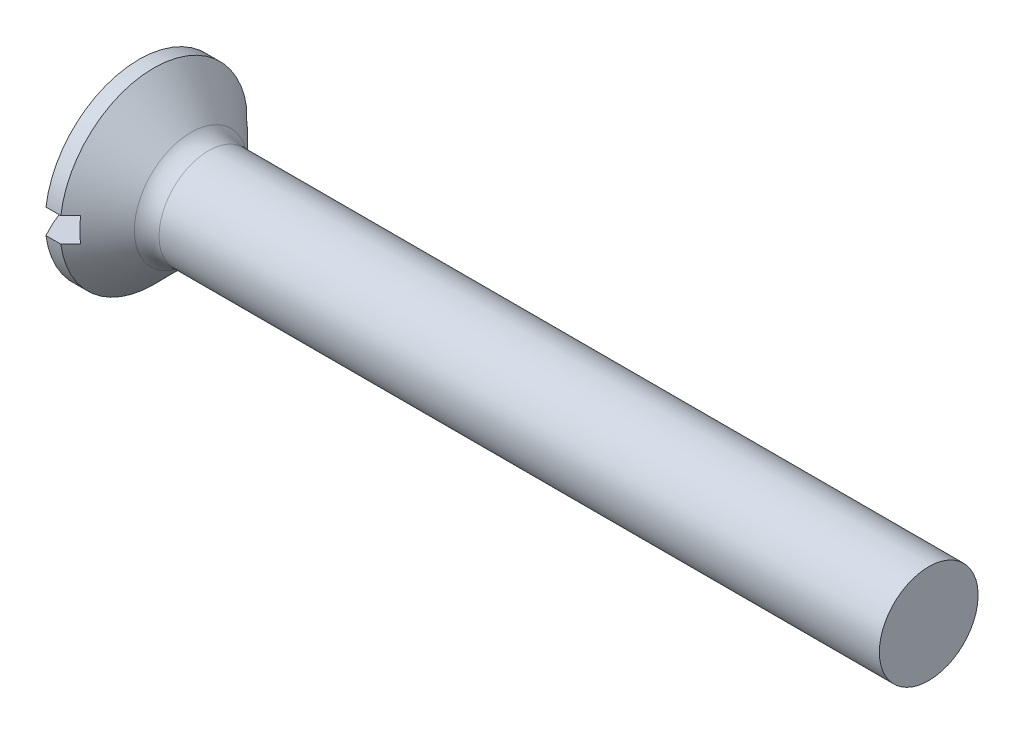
SolidWorks part; units mm, degrees
ref_plane "Plane1" through (0, 0, 0) normal (0, 0, 1) x (1, 0, 0)
ref_plane "Plane2" through (0, 0, 0) normal (0, 1, 0) x (1, 0, 0)
ref_plane "Plane3" through (0, 0, 0) normal (1, 0, 0) x (0, 0, -1)
revolve "Base-Revolve" add sketch "BodySke"
sketch "BodySke" plane through (0, 0, 0) normal (0, 0, 1) x (1, 0, 0)
  line L0 (0, 0) -> (16.5, 0)
  line L1 (16.5, 0) -> (16.5, 1)
  line L2 (16.5, 1) -> (1.7, 1)
  line L3 (0.8, -1.9) -> (1.7, -1) construction
  line L4 (-15.875, 0) -> (82.55, 0) construction
  line L5 (0.8, 1.9) -> (1.7, 1)
  line L6 (2.1, 4.175) -> (2.1, -11.7) construction
  line L7 (0.5, 2.7793) -> (0.5, -13.0957) construction
  line L8 (0.8, 1.9) -> (0.5, 1.9)
  arc A0 (0, 0) -> (0.5, 1.9) centre (3.86, 0) cw
  dimension "Length" = 16
  dimension "Diameter" = 2
  dimension "Head_dia" = 3.8
  dimension "Head_ang" = 90
  dimension "Advance" = 0.4
  dimension "Thread_nom" = 16
  dimension "Oval_ht" = 0.5
  dimension "Side_ht" = 1.2
extrude "Slot" cut sketch "Sketch2" along normal blind 1
sketch "Sketch2" plane through (0, 0, 0) normal (1, 0, 0) x (0, 0, -1)
  line L0 (1.9, -0.25) -> (-1.9, -0.25)
  line L1 (1.9, -0.25) -> (1.9, 0.25)
  line L2 (-1.9, 0.25) -> (1.9, 0.25)
  line L3 (-1.9, 0.25) -> (-1.9, -0.25)
  dimension "D1" = 3.8
  dimension "Slot_width" = 0.5
  dimension "D3" = 1.9
  dimension "D4" = 0.25
fillet "Fillet1" radius 0.5 1 edges at (1.7, 0, 1)
sketch "ThdSchSke" plane through (0, 0, 0) normal (0, 0, 1) x (1, 0, 0)
  line L0 (2.1, -0.774) -> (1.9418, -1)
  line L1 (2.1, -0.774) -> (2.2582, -1)
  line L2 (2.2582, -1) -> (2.2582, -1.25)
  line L3 (-3.175, 0) -> (5.1513, 0) construction
  line L5 (2.2582, -1.25) -> (1.9418, -1.25)
  line L6 (1.9418, -1.25) -> (1.9418, -1)
  dimension "Thread_minor" = 1.548
  dimension "Diameter" = 2
  dimension "Start" = 2.1
  dimension "SideAngle" = 55
  dimension "VeeAngle" = 70
  dimension "Overcut" = 2.5
revolve "ThreadSchematic" [suppressed] cut sketch "ThdSchSke" angle 360 about L3
pattern_linear "ThdSchPat" [suppressed]
equation "\"D1@Sketch2\" = \"Head_dia@BodySke\""
equation "\"D3@Sketch2\" = \"D1@Sketch2\" / 2"
equation "\"D4@Sketch2\" = \"Slot_width@Sketch2\" / 2"
equation "\"Thread_length@ThreadCosmetic\" = ((sgn( (\"Length@BodySke\" - \"Advance@BodySke\" - \"Side_ht@BodySke\" ) - \"Thread_nom@BodySke\" )-1)*( (\"Length@BodySke\" - \"Advance@BodySke\" - \"Side_ht@BodySke\" ) - \"Thread_"
equation "\"Thread_minor@ThdSchSke\" = \"Thread_minor@ThreadCosmetic\""
equation "\"Diameter@ThdSchSke\" = \"Diameter@BodySke\""
equation "\"Overcut@ThdSchSke\" = \"Diameter@BodySke\" * 1.25"
equation "\"Start@ThdSchSke\" = \"Oval_ht@BodySke\" + \"Length@BodySke\" - \"Thread_length@ThreadCosmetic\"  '---Countersunk---"
equation "\"Num_threads@ThdSchPat\" = int( \"Thread_length@ThreadCosmetic\" / \"Advance@BodySke\" + 0.999 )  + 1"
equation "\"Advance@ThdSchPat\" = \"Thread_length@ThreadCosmetic\" /  (\"Num_threads@ThdSchPat\" - 1) 'relax it"
